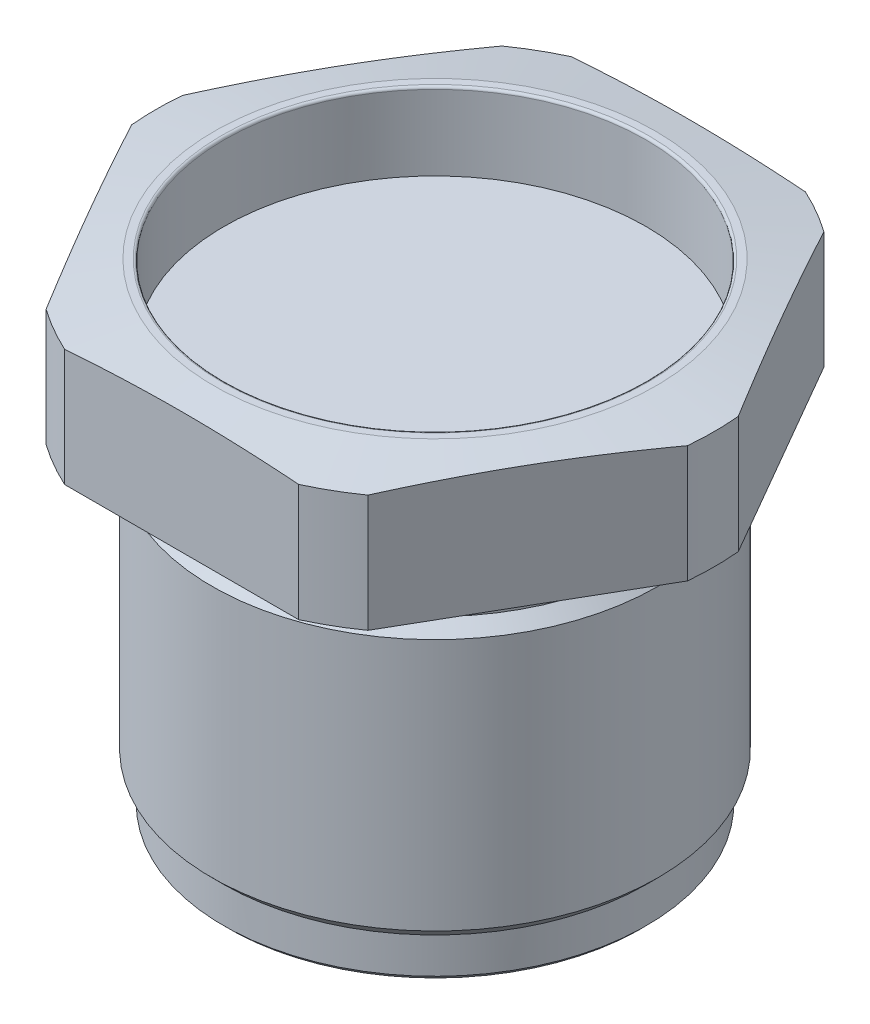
SolidWorks part; units mm, degrees
ref_plane "Front Plane" through (0, 0, 0) normal (0, 0, 1) x (1, 0, 0)
ref_plane "Top Plane" through (0, 0, 0) normal (0, 1, 0) x (1, 0, 0)
ref_plane "Right Plane" through (0, 0, 0) normal (1, 0, 0) x (0, 0, -1)
sketch "Sketch6" plane through (0, 0, 0) normal (0, 0, 1) x (1, 0, 0)
  line L0 (0, -8.9689) -> (0, 71.3762) construction
  line L1 (21.0185, 12.7) -> (21.9964, 12.7)
  line L2 (21.9964, 12.7) -> (27.813, 11.6744)
  line L3 (27.813, 11.6744) -> (27.813, 0)
  line L4 (27.813, 0) -> (21.0566, 0)
  line L5 (21.0566, 0) -> (21.0566, -34.8488)
  line L6 (21.0566, -34.8488) -> (0, -34.8488)
  line L7 (0, -34.8488) -> (0, 4.9784)
  line L8 (21.0185, 12.7) -> (21.0185, 4.9784)
  line L9 (21.0185, 4.9784) -> (0, 4.9784)
  dimension "D1" = 42.1132
  dimension "D2" = 12.7
  dimension "D3" = 34.8488
  dimension "D4" = 55.626
  dimension "D5" = 10
  dimension "D6" = 43.9928
  dimension "D7" = 7.7216
  dimension "D8" = 42.037
  dimension "D9" = 47.5488
revolve "Revolve3" add sketch "Sketch6" angle 360 about L0
fillet "Fillet7" radius 0.25 1 edges at (0, 12.7, -21.0185)
sketch "Sketch7" plane through (0, 0, 0) normal (0, -1, 0) x (1, 0, 0)
  line L0 (0, 0) -> (0, -52.3237) construction
  line L1 (-14.5781, 25.25) -> (14.5781, 25.25)
  line L2 (14.5781, 25.25) -> (29.1562, 0)
  line L3 (29.1562, 0) -> (14.5781, -25.25)
  line L4 (14.5781, -25.25) -> (-14.5781, -25.25)
  line L5 (-14.5781, -25.25) -> (-29.1562, 0)
  line L6 (-29.1562, 0) -> (-14.5781, 25.25)
  circle A0 centre (0, 0) radius 29.1562 construction
  dimension "D1" = 50.5
extrude "Cut-Extrude5" cut sketch "Sketch7" against normal through all flip side to cut
chamfer "Chamfer2" distance 0.5 angle 45 1 edges at (0, -34.8488, -21.0566)
sketch "Sketch8" plane through (0, 0, 0) normal (0, 0, 1) x (1, 0, 0)
  line L0 (-21.0566, -3.302) -> (-21.0566, -30.7848)
  line L1 (-21.0566, 0) -> (-21.0566, -34.3488) construction
  line L2 (-21.0566, -30.7848) -> (-22.225, -29.6164)
  line L3 (-22.225, -29.6164) -> (-22.225, -4.4704)
  line L4 (-22.225, -4.4704) -> (-21.0566, -3.302)
  line L5 (0, 0) -> (0, -34.3488) construction
  line L6 (-21.0566, -34.3488) -> (21.0566, -34.3488) construction
  line L7 (-20.5566, -34.8488) -> (20.5566, -34.8488) construction
  line L9 (-16.0362, 0) -> (-27.6981, 0) construction
  dimension "D1" = 45
  dimension "D2" = 44.45
  dimension "D3" = 4.064
  dimension "D4" = 3.302
revolve "Revolve4" add sketch "Sketch8" angle 360 about L5
fillet "Fillet8" radius 1.016 1 edges at (0, 0, -21.0566)
sketch "Sketch9" plane through (0, 0, 0) normal (0, 0, 1) x (1, 0, 0)
  line L0 (0, 0) -> (0, -34.8488) construction
  line L1 (-20.5566, -34.8488) -> (20.5566, -34.8488) construction
  line L2 (0, -34.8488) -> (0, -33.4772)
  line L3 (0, -33.4772) -> (7.5819, -33.4772)
  line L4 (7.5819, -33.4772) -> (7.5819, -34.8488)
  line L5 (7.5819, -34.8488) -> (0, -34.8488)
  line L6 (9.3853, -34.8488) -> (9.3853, -34.3154)
  line L7 (9.5631, -34.8488) -> (9.3853, -34.8488)
  line L8 (11.1633, -34.3154) -> (11.1633, -34.8488)
  line L9 (11.1633, -34.8488) -> (10.9855, -34.8488)
  line L10 (13.5636, -33.4772) -> (18.1864, -33.4772)
  line L12 (17.4398, -34.8488) -> (12.192, -34.8488)
  arc A0 (13.5636, -33.4772) -> (12.192, -34.8488) centre (13.5636, -34.8488) ccw
  arc A1 (18.1864, -33.4772) -> (17.4398, -34.8488) centre (18.1864, -34.3662) ccw
  arc A2 (9.3853, -34.3154) -> (9.5631, -34.8488) centre (10.2743, -34.3154) ccw
  arc A3 (10.9855, -34.8488) -> (11.1633, -34.3154) centre (10.2743, -34.3154) ccw
  point P14 (13.5636, -33.4772)
  dimension "D2" = 1.778
  dimension "D1" = 0.4826
  dimension "D3" = 36.3728
  dimension "D4" = 24.384
  dimension "D5" = 15.1638
  dimension "D6" = 20.5486
revolve "Cut-Revolve1" cut sketch "Sketch9" angle 360 about L0
sketch "Sketch10" plane through (0, 0, 0) normal (0, 0, 1) x (1, 0, 0)
  line L0 (-18.933, -34.798) -> (-17.4398, -34.798)
  line L2 (-11.0209, -34.798) -> (-9.5277, -34.798)
  line L3 (0, 0) -> (0, -34.798) construction
  arc A1 (-18.933, -34.798) -> (-17.4398, -34.798) centre (-18.1864, -34.3154) ccw
  arc A5 (-11.0209, -34.798) -> (-9.5277, -34.798) centre (-10.2743, -34.3154) ccw
revolve "Revolve6" add sketch "Sketch10" angle 360 about L3
